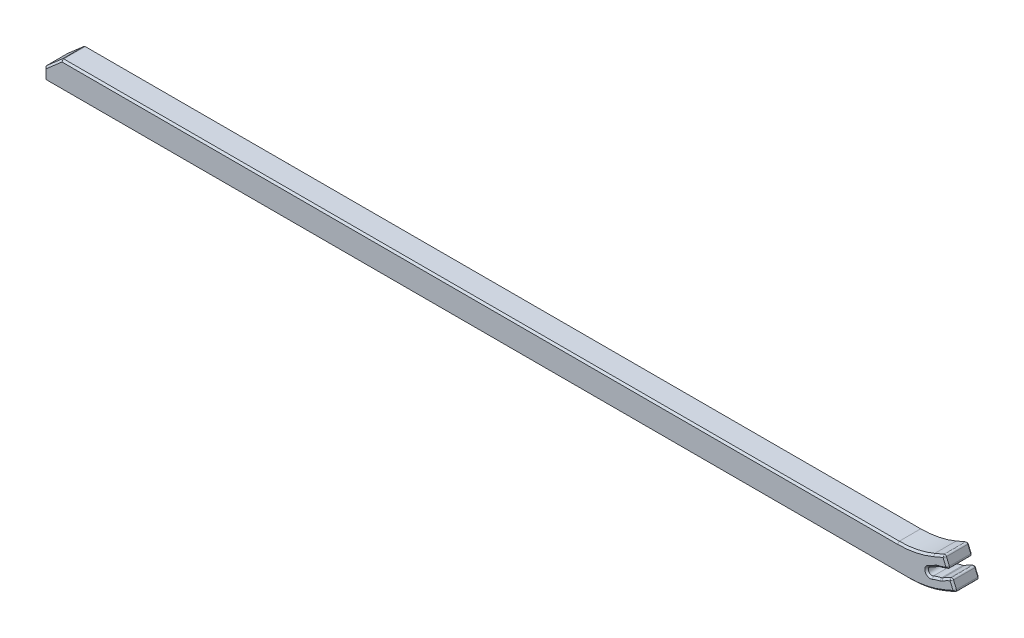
SolidWorks part; units mm, degrees
ref_plane "前视基准面" through (0, 0, 0) normal (0, 0, 1) x (1, 0, 0)
ref_plane "上视基准面" through (0, 0, 0) normal (0, 1, 0) x (1, 0, 0)
ref_plane "右视基准面" through (0, 0, 0) normal (1, 0, 0) x (0, 0, -1)
sketch "草图3" plane through (0, 0, 0) normal (0, 0, 1) x (1, 0, 0)
  line L0 (41.7566, 0.7844) -> (42.0827, 0.016)
  line L1 (-58.0267, 1.5) -> (35.6711, 1.5086)
  line L2 (-59.8218, -1.5) -> (36.9478, -1.5)
  line L3 (40.9333, -0.6891) -> (41.9768, -0.2462)
  line L5 (39.6556, 2.3195) -> (40.6996, 2.7626)
  line L6 (40.9618, 2.6566) -> (41.2877, 1.889)
  line L8 (-59.9531, -0.1115) -> (-58.158, 1.4509)
  line L9 (41.4943, 0.8903) -> (41.418, 0.8579)
  line L15 (-60.0218, -0.2624) -> (-60.0218, -1.3)
  arc A3 (40.4034, 0.3281) -> (40.5784, 0.4024) centre (40.2991, 0.8171) ccw
  arc A4 (40.1948, 1.3061) -> (40.0198, 1.2318) centre (40.2991, 0.8171) ccw
  arc A5 (40.5784, 0.4024) -> (41.418, 0.8579) centre (43.3717, -3.7446) cw
  arc A6 (40.4034, 0.3281) -> (39.4925, 0.0406) centre (41.4461, -4.5619) ccw
  arc A7 (40.1948, 1.3061) -> (41.1849, 1.6281) centre (39.152, 6.1962) ccw
  arc A8 (40.0198, 1.2318) -> (39.1802, 0.7763) centre (37.2265, 5.3788) cw
  arc A9 (42.0827, 0.016) -> (41.9768, -0.2462) centre (41.8986, -0.0621) cw
  arc A10 (41.7566, 0.7844) -> (41.4943, 0.8903) centre (41.5725, 0.7062) ccw
  arc A11 (40.6996, 2.7626) -> (40.9618, 2.6566) centre (40.7777, 2.5785) cw
  arc A12 (41.2877, 1.889) -> (41.1849, 1.6281) centre (41.1036, 1.8108) cw
  arc A15 (39.1802, 0.7763) -> (39.4925, 0.0406) centre (39.3363, 0.4085) ccw
  arc A16 (-59.8218, -1.5) -> (-60.0218, -1.3) centre (-59.8218, -1.3) cw
  arc A18 (-58.0267, 1.5) -> (-58.158, 1.4509) centre (-58.0267, 1.3) ccw
  arc A19 (-59.9531, -0.1115) -> (-60.0218, -0.2624) centre (-59.8218, -0.2624) ccw
  arc A20 (39.6556, 2.3195) -> (35.6711, 1.5086) centre (35.6702, 11.7086) cw
  arc A21 (40.9333, -0.6891) -> (36.9478, -1.5) centre (36.9478, 8.7) cw
  point P3 (-8.5218, 0)
  point P13 (39.9533, 0.6704)
  point P32 (39.8663, 1.0676)
  dimension "D1" = 10.2
  dimension "D6" = 0.2
  dimension "D7" = 0.2
  dimension "D2" = 10.2
extrude "凸台-拉伸2" add sketch "草图3" along normal blind 2.8
chamfer "倒角1" distance 0.2 angle 45 50 edges at (38.9813, -1.2952, 0) (41.455, -0.4677, 0) (42.084, -0.137, 0) (41.9196, 0.4002, 0) (41.6474, 0.8917, 0) (41.4562, 0.8741, 0) (40.9873, 0.6503, 0) (40.4944, 0.3569, 0) (39.941, 0.2062, 0) (38.9684, 0.2523, 0) (39.6109, 0.984, 0) (40.1037, 1.2774, 0) (40.6983, 1.4413, 0) (41.2897, 1.7375, 0) (41.1248, 2.2728, 0) (40.8527, 2.7639, 0) (40.1776, 2.541, 0) (37.7042, 1.7135, 0) (-11.1778, 1.5043, 0) (-58.0968, 1.4874, 0) (-59.0555, 0.6697, 0) (-60.0038, -0.1795, 0) (-60.0218, -0.7812, 0) (-59.9632, -1.4414, 0) (-11.437, -1.5, 0) (-60.0218, -0.7812, 2.8) (-60.0038, -0.1795, 2.8) (-59.0555, 0.6697, 2.8) (-58.0968, 1.4874, 2.8) (-11.1778, 1.5043, 2.8) (37.7042, 1.7135, 2.8) (40.1776, 2.541, 2.8) (40.8527, 2.7639, 2.8) (41.1248, 2.2728, 2.8) (41.2897, 1.7375, 2.8) (40.6983, 1.4413, 2.8) (40.1037, 1.2774, 2.8) (39.6109, 0.984, 2.8) (38.9684, 0.2523, 2.8) (39.941, 0.2062, 2.8) (40.4944, 0.3569, 2.8) (40.9873, 0.6503, 2.8) (41.4562, 0.8741, 2.8) (41.6474, 0.8917, 2.8) (41.9196, 0.4002, 2.8) (42.084, -0.137, 2.8) (41.455, -0.4677, 2.8) (38.9813, -1.2952, 2.8) (-11.437, -1.5, 2.8) (-59.9632, -1.4414, 2.8)
